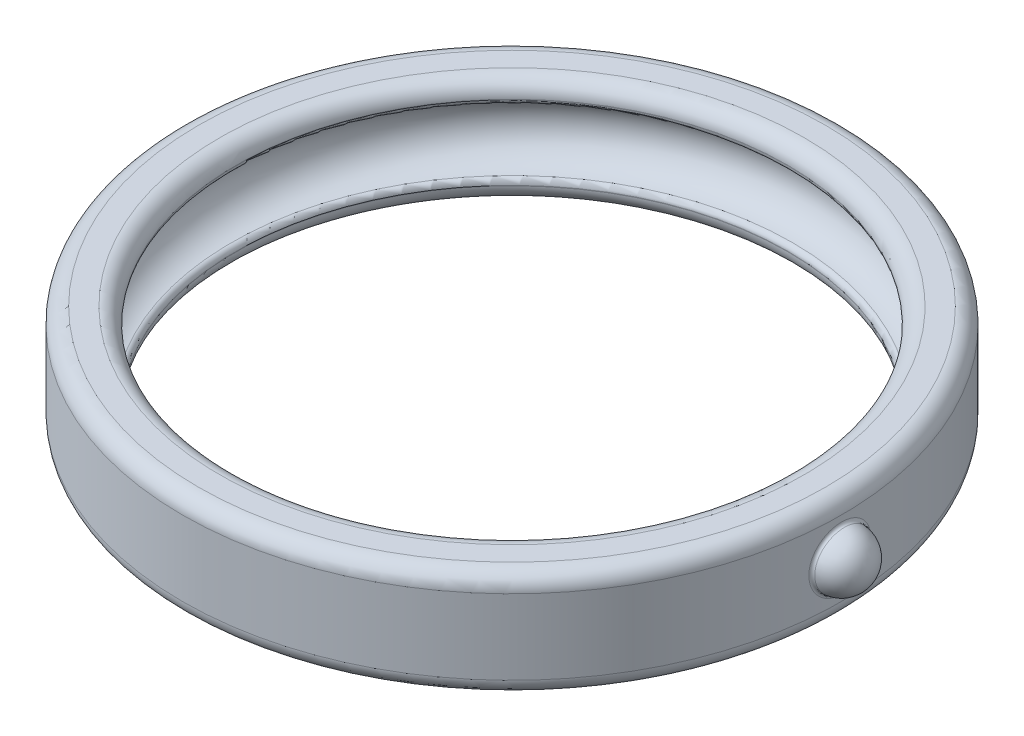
SolidWorks part; units mm, degrees
ref_plane "前视基准面" through (0, 0, 0) normal (0, 0, 1) x (1, 0, 0)
ref_plane "上视基准面" through (0, 0, 0) normal (0, 1, 0) x (1, 0, 0)
ref_plane "右视基准面" through (0, 0, 0) normal (1, 0, 0) x (0, 0, -1)
sketch "草图1" plane through (0, 0, 0) normal (0, 0, 1) x (1, 0, 0)
  line L0 (0, 0) -> (0, 47.0541) construction
  line L1 (25.8, 8.4641) -> (25.8, 8.5)
  line L2 (27.3, 0) -> (29.3, 0)
  line L3 (25.8, 1.5) -> (25.8, 1.5359)
  line L4 (27.3, 10) -> (29.3, 10)
  line L5 (30.8, 1.5) -> (30.8, 8.5)
  arc A0 (26.2286, 2.0308) -> (26.2286, 7.9692) centre (25.8, 5) ccw
  arc A1 (25.8, 8.5) -> (27.3, 10) centre (27.3, 8.5) cw
  arc A2 (27.3, 0) -> (25.8, 1.5) centre (27.3, 1.5) cw
  arc A3 (29.3, 0) -> (30.8, 1.5) centre (29.3, 1.5) ccw
  arc A4 (29.3, 10) -> (30.8, 8.5) centre (29.3, 8.5) cw
  arc A5 (26.2286, 7.9692) -> (25.8, 8.4641) centre (26.3, 8.4641) cw
  arc A6 (26.2286, 2.0308) -> (25.8, 1.5359) centre (26.3, 1.5359) ccw
  point P12 (25.8, 10)
  point P17 (30.8, 0)
  point P20 (30.8, 10)
  point P23 (25.8, 8)
revolve "旋转1" add sketch "草图1" angle 360 about L0
sketch "草图2" plane through (0, 0, 0) normal (0, 0, 1) x (1, 0, 0)
  line L0 (30.8, 1.5) -> (30.8, 8.5) construction
  line L1 (30.8, 5) -> (30.8, -0.5229) construction
  line L2 (30.8, 7.65) -> (30.8, 2.35)
  arc A0 (30.8, 2.35) -> (30.8, 7.65) centre (30.8, 5) ccw
  dimension "D1" = 5.3
revolve "旋转4" add sketch "草图2" angle 110 about L1
sketch "草图3" plane through (0, 0, 0) normal (0, 0, 1) x (1, 0, 0)
  line L0 (-30.8, 8.5) -> (-30.8, 1.5) construction
  line L1 (-30.8, 7.65) -> (-30.8, 2.35)
  line L2 (-30.8, 7.65) -> (-30.8, -1.9068) construction
  arc A0 (-30.8, 7.65) -> (-30.8, 2.35) centre (-30.8, 5) ccw
  dimension "D1" = 5.3
revolve "旋转5" add sketch "草图3" angle 110 about L2
fillet "圆角2" radius 0.3 2 edges at (30.6918, 4.4015, 2.5793) (-30.6918, 4.4015, -2.5793)
equation "\"len1\"=30.8"
equation "\"len2\"= 45"
equation "\"len3\"= 40"
equation "\"D1@草图1\"=\"len1\""
